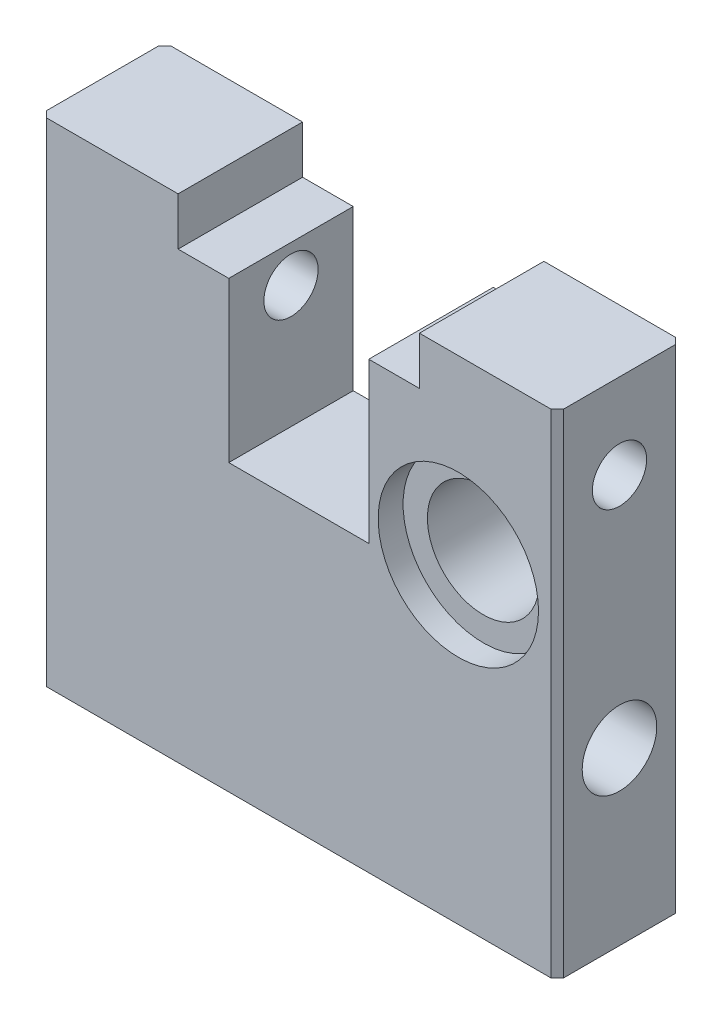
SolidWorks part; units mm, degrees
ref_plane "Спереди" through (0, 0, 0) normal (0, 0, 1) x (1, 0, 0)
ref_plane "Сверху" through (0, 0, 0) normal (0, 1, 0) x (1, 0, 0)
ref_plane "Справа" through (0, 0, 0) normal (1, 0, 0) x (0, 0, -1)
sketch "Эскиз1" plane through (0, 0, 0) normal (0, 0, 1) x (1, 0, 0)
  line L0 (0, -21.3375) -> (0, 18.161) construction
  line L1 (7.6835, 31.369) -> (16.4592, 31.369)
  line L2 (-16.4592, 0) -> (16.4592, 0)
  line L3 (-16.4592, 0) -> (-16.4592, 31.369)
  line L4 (-16.4592, 31.369) -> (-7.6835, 31.369)
  line L5 (16.4592, 0) -> (16.4592, 31.369)
  line L6 (-4.4577, 28.321) -> (-7.6835, 28.321)
  line L7 (7.6835, 31.369) -> (7.6835, 28.321)
  line L8 (7.6835, 28.321) -> (4.4577, 28.321)
  line L9 (-7.6835, 31.369) -> (-7.6835, 28.321)
  line L11 (4.4577, 28.321) -> (4.4577, 18.161)
  line L12 (4.4577, 18.161) -> (-4.4577, 18.161)
  line L13 (-4.4577, 28.321) -> (-4.4577, 18.161)
  circle A0 centre (10.16, 19.8399) radius 3.556
  dimension "D8" = 7.112
  dimension "D1" = 18.161
  dimension "D2" = 28.321
  dimension "D3" = 31.369
  dimension "D4" = 32.9184
  dimension "D5" = 15.367
  dimension "D6" = 8.9154
  dimension "D7" = 19.8399
  dimension "D9" = 6.2992
extrude "Бобышка-Вытянуть1" add sketch "Эскиз1" along normal blind 7.9248
sketch "Эскиз2" plane through (0, 0, 7.9248) normal (0, 0, 1) x (1, 0, 0)
  circle A0 centre (10.16, 19.8399) radius 5.1054
  circle A1 centre (10.16, 19.8399) radius 3.556 construction
  dimension "D1" = 10.2108
extrude "Вырез-Вытянуть1" cut sketch "Эскиз2" against normal blind 1.5875
sketch "Эскиз3" plane through (-16.4592, 0, 0) normal (-1, 0, 0) x (0, 0, 1)
  line L0 (7.9248, 31.369) -> (7.9248, 0) construction
  line L1 (7.9248, 0) -> (0, 0) construction
  circle A0 centre (3.9624, 25.9588) radius 1.7272
  circle A1 centre (3.9624, 10.8966) radius 2.3749
  dimension "D1" = 4.7498
  dimension "D3" = 3.4544
  dimension "D2" = 3.9624
  dimension "D4" = 15.0622
  dimension "D5" = 10.8966
extrude "Вырез-Вытянуть2" cut sketch "Эскиз3" against normal through all
sketch "Эскиз4" plane through (-16.4592, 0, 0) normal (-1, 0, 0) x (0, 0, 1)
  circle A0 centre (3.9624, 25.9588) radius 3.2004
  circle A1 centre (3.9624, 25.9588) radius 1.7272 construction
  dimension "D1" = 6.4008
extrude "Вырез-Вытянуть3" cut sketch "Эскиз4" against normal blind 7.1437
chamfer "Фаска1" distance 0.3969 angle 45 4 edges at (16.4592, 15.6845, 0) (16.4592, 15.6845, 7.9248) (-16.4592, 15.6845, 0) (-16.4592, 15.6845, 7.9248)
